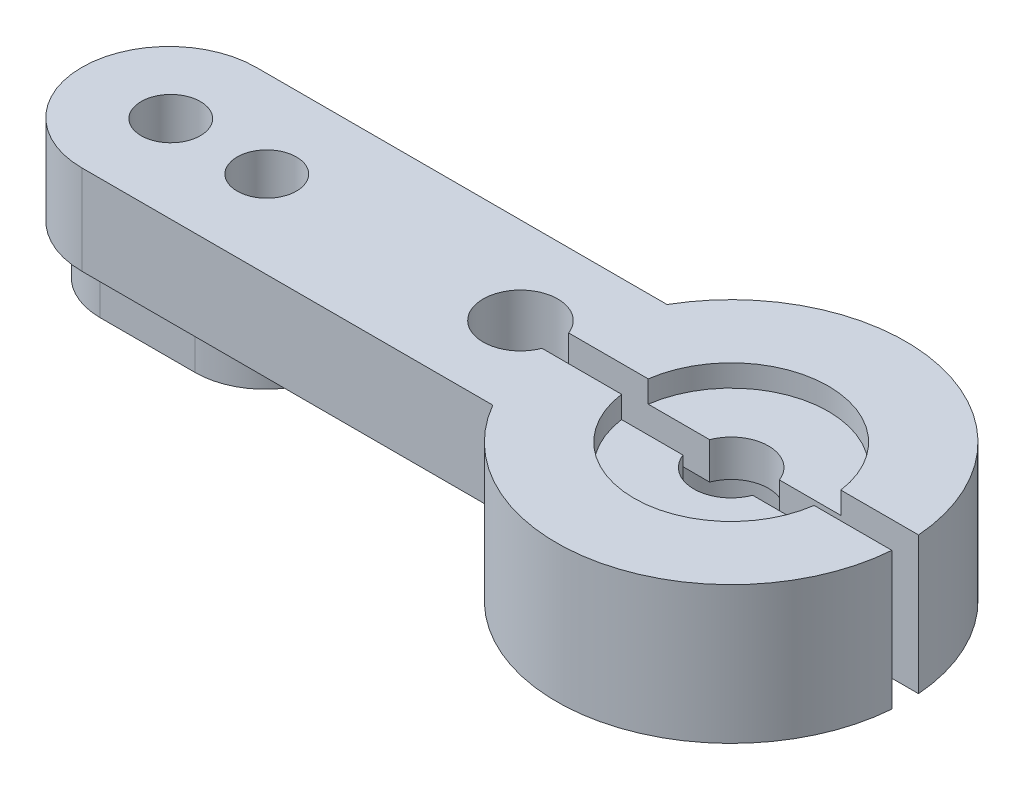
SolidWorks part; units mm, degrees
ref_plane "Front Plane" through (0, 0, 0) normal (0, 0, 1) x (1, 0, 0)
ref_plane "Top Plane" through (0, 0, 0) normal (0, 1, 0) x (1, 0, 0)
ref_plane "Right Plane" through (0, 0, 0) normal (1, 0, 0) x (0, 0, -1)
sketch "Sketch1" plane through (0, 0, 0) normal (0, 1, 0) x (1, 0, 0)
  circle A0 centre (0, 0) radius 7.4803
  dimension "D1" = 14.9606
extrude "Boss-Extrude1" add sketch "Sketch1" along normal blind 5.8928
sketch "Sketch2" plane through (0, 0, 0) normal (0, -1, 0) x (1, 0, 0)
  circle A0 centre (0, 0) radius 2.7813
  dimension "D1" = 5.5626
extrude "Cut-Extrude1" cut sketch "Sketch2" against normal blind 3.3782
sketch "Sketch4" plane through (0, 5.8928, 0) normal (0, 1, 0) x (1, 0, 0)
  line L0 (-24.0919, 3.7338) -> (-6.4818, 3.7338)
  line L1 (-24.0919, -3.7338) -> (-6.4818, -3.7338)
  arc A0 (-24.0919, 3.7338) -> (-24.0919, -3.7338) centre (-24.0919, 0) ccw
  circle A1 centre (0, 0) radius 7.4803 construction
  circle A3 centre (0, 0) radius 7.4803
  arc A4 (-6.4818, 3.7338) -> (-6.4818, -3.7338) centre (0, 0) ccw
  point P3 (-27.8257, 0)
  dimension "D1" = 27.8257
  dimension "D2" = 7.4676
  dimension "D3" = 0
extrude "Boss-Extrude2" add sketch "Sketch4" against normal blind 3.8354
sketch "Sketch5" plane through (0, 2.0574, 0) normal (0, -1, 0) x (1, 0, 0)
  line L0 (-24.0284, 0) -> (-19.9644, 0) construction
  line L1 (-24.0284, 3.0099) -> (-19.9644, 3.0099)
  line L2 (-24.0284, -3.0099) -> (-19.9644, -3.0099)
  arc A0 (-24.0284, 3.0099) -> (-24.0284, -3.0099) centre (-24.0284, 0) ccw
  arc A1 (-19.9644, -3.0099) -> (-19.9644, 3.0099) centre (-19.9644, 0) ccw
  arc A2 (-24.0919, 3.7338) -> (-24.0919, -3.7338) centre (-24.0919, 0) ccw construction
  point P3 (-21.9964, 0)
  point P10 (-27.0383, 0)
  point P11 (-16.9545, 0)
  point P15 (-27.8257, 0)
  dimension "D1" = 6.0198
  dimension "D2" = 10.0838
  dimension "D3" = 0.7874
extrude "Boss-Extrude3" add sketch "Sketch5" along normal blind 2.0574
sketch "Sketch6" plane through (0, 5.8928, 0) normal (0, 1, 0) x (1, 0, 0)
  circle A0 centre (0, 0) radius 4.1656
  dimension "D1" = 8.3312
extrude "Cut-Extrude2" cut sketch "Sketch6" against normal blind 0.9398
sketch "Sketch7" plane through (0, 5.8928, 0) normal (0, 1, 0) x (1, 0, 0)
  line L0 (-24.0157, 0) -> (-19.9009, 0) construction
  line L1 (-9.0297, 0.5715) -> (9.2253, 0.5715)
  line L2 (-9.0297, 0.5715) -> (-9.0297, -0.5715)
  line L3 (-9.0297, -0.5715) -> (9.2253, -0.5715)
  line L4 (9.2253, 0.5715) -> (9.2253, -0.5715)
  line L5 (-24.0157, 0) -> (-27.8257, 0) construction
  circle A0 centre (-9.0297, 0) radius 1.6002
  circle A1 centre (0, 0) radius 1.6002
  circle A2 centre (-24.0157, 0) radius 1.27
  circle A3 centre (-19.9009, 0) radius 1.27
  arc A4 (-24.0919, 3.7338) -> (-24.0919, -3.7338) centre (-24.0919, 0) ccw construction
  point P4 (9.2253, 0)
  point P6 (-9.0297, 0)
  dimension "D3" = 3.2004
  dimension "D4" = 2.54
  dimension "D5" = 4.1148
  dimension "D1" = 1.143
  dimension "D2" = 9.0297
  dimension "D6" = 3.81
extrude "Cut-Extrude3" cut sketch "Sketch7" against normal through all contours A2 | A3 | A0 | L1 L4 L3 L2 | A1
